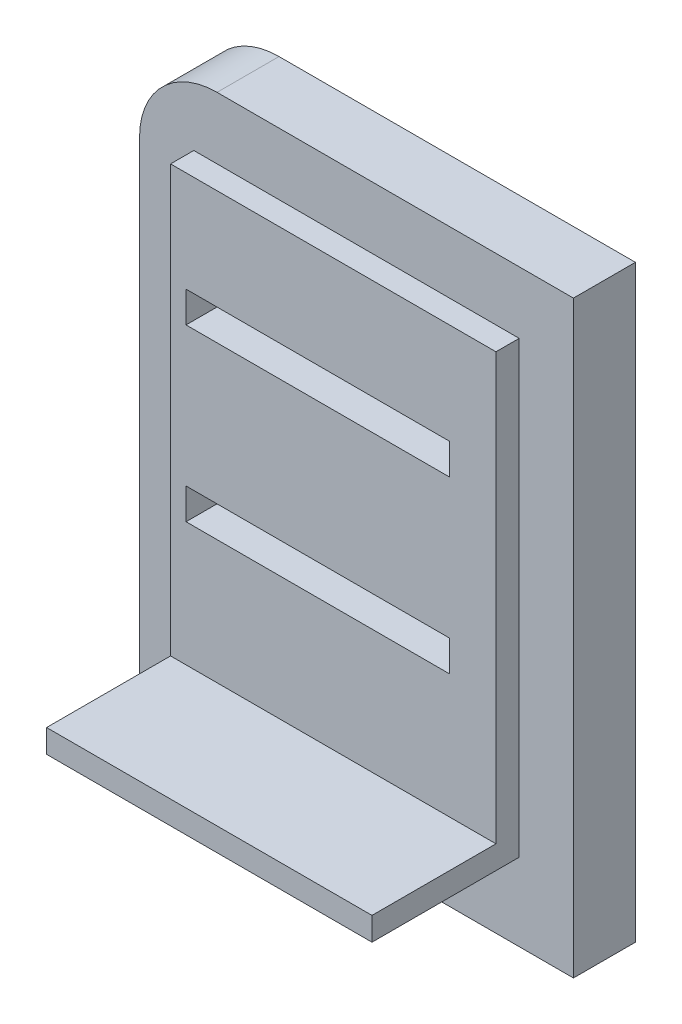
SolidWorks part; units mm, degrees
ref_plane "Face" through (0, 0, 0) normal (0, 0, 1) x (1, 0, 0)
ref_plane "Dessus" through (0, 0, 0) normal (0, 1, 0) x (1, 0, 0)
ref_plane "Droite" through (0, 0, 0) normal (1, 0, 0) x (0, 0, -1)
sketch "Esquisse1" plane through (0, 0, 0) normal (0, 0, 1) x (1, 0, 0)
  line L0 (0, 0) -> (14, 0) construction
  line L1 (-14, 19) -> (14, 19)
  line L2 (-14, 19) -> (-14, -19)
  line L3 (-14, -19) -> (14, -19)
  line L4 (14, 19) -> (14, -19)
  line L5 (0, 0) -> (0, -19) construction
  dimension "D1" = 28
  dimension "D2" = 38
extrude "Prisme de base" add sketch "Esquisse1" along normal mid plane 4
fillet "Congé " radius 5
shell "Coque " thickness 2
sketch "Esquisse2" plane through (0, 0, 2) normal (0, 0, 1) x (1, 0, 0)
  line L0 (0, 15) -> (0, -19) construction
  line L1 (-10.5, 15) -> (10.5, 15)
  line L2 (-10.5, 15) -> (-10.5, -14)
  line L3 (-10.5, -14) -> (10.5, -14)
  line L4 (10.5, 15) -> (10.5, -14)
  line L5 (-14, -19) -> (14, -19) construction
  line L6 (14, 19) -> (-9, 19) construction
  dimension "D1" = 21
  dimension "D2" = 5
  dimension "D3" = 4
extrude "Bossage avant" add sketch "Esquisse2" along normal blind 1.5
sketch "Esquisse3" plane through (0, 0, 3.5) normal (0, 0, 1) x (1, 0, 0)
  line L0 (-10.5, 15) -> (-10.5, -14) construction
  line L1 (10.5, -14) -> (-10.5, -14)
  line L2 (10.5, -14) -> (10.5, -12.5)
  line L3 (10.5, -12.5) -> (-10.5, -12.5)
  line L4 (-10.5, -14) -> (-10.5, -12.5)
  dimension "D1" = 1.5
extrude "L" add sketch "Esquisse3" along normal blind 8
sketch "Esquisse4" plane through (0, 0, 3.5) normal (0, 0, 1) x (1, 0, 0)
  line L0 (-10.5, 15) -> (-10.5, -12.5) construction
  line L1 (-9.5, -2.5) -> (7.5, -2.5)
  line L2 (-9.5, -2.5) -> (-9.5, -4.5)
  line L3 (-9.5, -4.5) -> (7.5, -4.5)
  line L4 (7.5, -2.5) -> (7.5, -4.5)
  line L5 (10.5, -12.5) -> (-10.5, -12.5) construction
  dimension "D1" = 1
  dimension "D2" = 17
  dimension "D3" = 2
  dimension "D4" = 8
extrude "Fente borne" cut sketch "Esquisse4" against normal through all
pattern_linear "Répétition linéaire1" count 2 spacing 11
